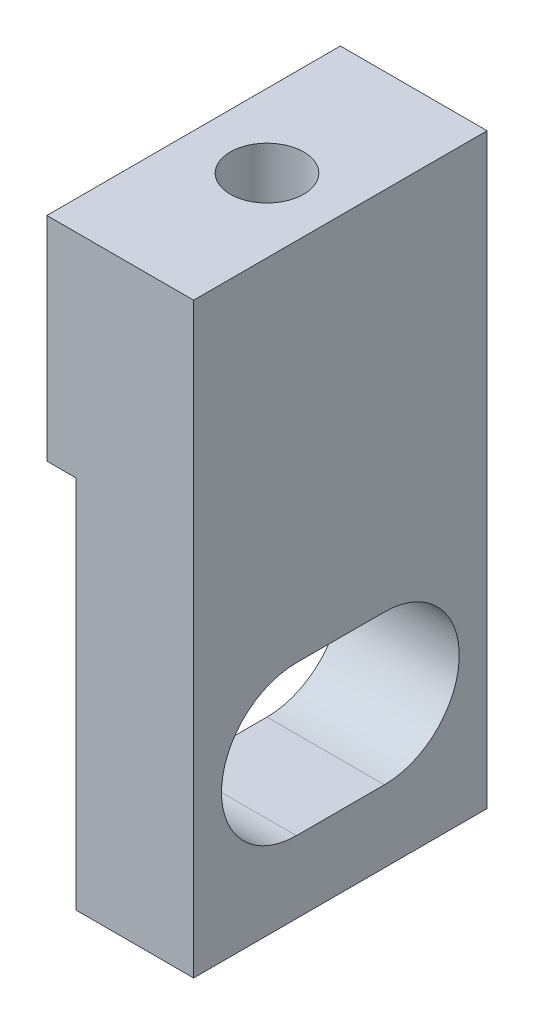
SolidWorks part; units mm, degrees
ref_plane "Plan de face" through (0, 0, 0) normal (0, 0, 1) x (1, 0, 0)
ref_plane "Plan de dessus" through (0, 0, 0) normal (0, 1, 0) x (1, 0, 0)
ref_plane "Plan de droite" through (0, 0, 0) normal (1, 0, 0) x (0, 0, -1)
sketch "Esquisse1" plane through (0, 0, 0) normal (0, 0, 1) x (1, 0, 0)
  line L0 (0, 0) -> (10, 0)
  line L1 (10, 0) -> (10, -40)
  line L2 (10, -40) -> (2, -40)
  line L3 (2, -40) -> (2, -14.5)
  line L4 (2, -14.5) -> (0, -14.5)
  line L5 (0, -14.5) -> (0, 0)
  dimension "D1" = 40
  dimension "D2" = 25.5
  dimension "D3" = 2
  dimension "D4" = 10
extrude "Extrusion1" add sketch "Esquisse1" along normal mid plane 20
sketch "Sketch2" plane through (10, -113.8676, 95.7607) normal (1, 0, 0) x (0, 0, -1)
  line L0 (92.7607, 78.7676) -> (98.7607, 78.7676)
  line L1 (98.7607, 88.9676) -> (92.7607, 88.9676)
  line L2 (85.7607, 113.8676) -> (105.7607, 113.8676) construction
  line L3 (95.7607, 88.9676) -> (95.7607, 78.7676) construction
  line L4 (85.7607, 73.8676) -> (85.7607, 113.8676) construction
  arc A0 (98.7607, 78.7676) -> (98.7607, 88.9676) centre (98.7607, 83.8676) ccw
  arc A1 (92.7607, 88.9676) -> (92.7607, 78.7676) centre (92.7607, 83.8676) ccw
  dimension "D1" = 5.1
  dimension "D2" = 16.2
  dimension "D3" = 30
  dimension "D4" = 10
extrude "lumiere H1" cut sketch "Sketch2" against normal up to next
hole_wizard "Trou taraudé M6x1.01" positions "Esquisse4" profile "Esquisse3" tap size "M6x1.0" standard "ISO"
sketch "Esquisse4" plane through (0, 0, 0) normal (0, 1, 0) x (-1, 0, 0)
  line L0 (0, 10) -> (0, -10) construction
  line L1 (-10, 10) -> (0, 10) construction
  point P0 (-5, 0)
  dimension "D1" = 5
  dimension "D2" = 10
sketch "Esquisse3" plane through (5, 0, 0) normal (1, 0, 0) x (0, 0, 1)
  line L0 (0, 0) -> (0, 17.5022)
  line L1 (0, 17.5022) -> (2.5, 16)
  line L2 (2.5, 16) -> (2.5, 0)
  line L5 (2.5, 0) -> (0, 0)
  line L10 (0, 17.5022) -> (-2.5, 16) construction
  line L11 (0, -6.35) -> (0, 107.95) construction
  dimension "Diamètre du trou pour taraudage" = 5
  dimension "Profondeur du trou pour taraudage" = 16
  dimension "Angle de pointe" = 118
